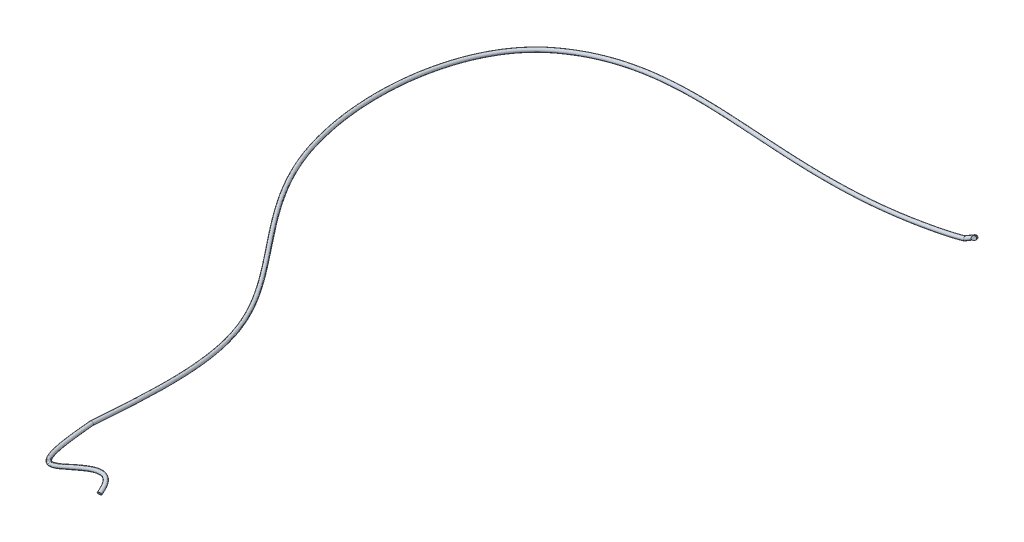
SolidWorks part; units mm, degrees
ref_plane "Plan de face" through (0, 0, 0) normal (0, 0, 1) x (1, 0, 0)
ref_plane "Plan de dessus" through (0, 0, 0) normal (0, 1, 0) x (1, 0, 0)
ref_plane "Plan de droite" through (0, 0, 0) normal (1, 0, 0) x (0, 0, -1)
sketch "Esquisse1" plane through (0, 0, 0) normal (0, 0, 1) x (1, 0, 0)
  circle A0 centre (-0.4672, 0.7119) radius 0.4
sketch "Esquisse5" plane through (0, 0, 0) normal (0, 1, 0) x (1, 0, 0)
  spline S0 degree 3 poles (0, 0) (0.8877, 11.4969) (1.7754, 22.9937) (-6.9183, 46.1293) (-33.5671, 64.9416) (-30.6029, 107.0581) (-3.239, 128.1038) (24.2261, 115.9792) (55.7374, 123.6922) (57.6422, 124.5241) knots 0 0 0 0 0.163429 0.163429 0.386168 0.613276 0.613276 0.943768 1 1 1 1
  spline S4 degree 3 poles (0.4041, 0) (0.6221, 3.0245) (0.9959, 8.2082) (1.1644, 15.515) (0.8905, 20.8142) (0.3247, 24.9342) (-0.2916, 27.9229) (-1.1305, 30.8339) (-2.2194, 33.6401) (-3.5355, 36.3493) (-5.5532, 39.8736) (-8.4741, 44.1244) (-12.3162, 49.0832) (-16.2662, 54.0741) (-20.0823, 59.2419) (-23.5196, 64.7355) (-25.847, 69.6875) (-27.2421, 73.891) (-28.0631, 77.1941) (-28.6537, 80.5771) (-29.1398, 85.1773) (-29.1856, 90.9371) (-28.3616, 97.6737) (-26.669, 103.9662) (-24.505, 108.6996) (-22.3167, 111.984) (-20.6923, 113.8881) (-19.1211, 115.3509) (-17.6984, 116.4498) (-15.9227, 117.5877) (-13.7543, 118.6759) (-10.2291, 119.9806) (-5.4028, 121.0117) (0.7788, 121.5069) (7.3284, 121.4851) (14.1312, 121.1438) (21.0698, 120.6831) (28.0239, 120.3016) (33.767, 120.2153) (38.2769, 120.3929) (42.6133, 120.7639) (46.9492, 121.4913) (52.3352, 122.7003) (55.6096, 123.5683) (57.7735, 124.1419) knots 0 0 0 0 0.044483 0.076237 0.107175 0.122199 0.137212 0.151907 0.166591 0.181315 0.196054 0.226133 0.256878 0.288082 0.319513 0.351079 0.383018 0.39949 0.415991 0.432907 0.449829 0.483815 0.517157 0.549103 0.579075 0.593007 0.606901 0.615682 0.624459 0.633238 0.646588 0.659962 0.688295 0.718635 0.750802 0.784317 0.818551 0.852823 0.886488 0.902764 0.919022 0.95031 0.967162 1 1 1 1 construction
sweep "Balayage1" add profiles "Esquisse1" path "Esquisse5"
sketch "Esquisse6" plane through (96.5575, 0, -51.3539) normal (0.8829, 0, -0.4696) x (-0.4696, 0, -0.8829)
  circle A0 centre (83.339, 0.7107) radius 0.4034
sketch3d "Esquisse3D1"
  line L0 (59.9922, 2.338, -124.3226) -> (59.9922, 2.3919, -123.3441) construction
  circle A0 centre (57.4243, 0.7107, -124.9337) radius 0.4034 construction
  spline S0 degree 3 poles (57.4243, 0.7107, -124.9337) (58.0347, 0.9574, -125.2497) (59.1734, 1.4175, -125.8392) (59.7327, 2.0463, -124.8022) (59.9922, 2.3381, -124.321) knots 0 0 0 0 0.536002 1 1 1 1
  point P8 (57.7805, 0.7107, -125.1231)
sweep "Balayage2" add profiles "Esquisse6" path "Esquisse3D1"
sketch "Esquisse7" plane through (0, 0, 0) normal (0, 0, 1) x (1, 0, 0)
  circle A0 centre (-0.4672, 0.7119) radius 0.4
  circle A1 centre (-0.4672, 0.7119) radius 0.4 construction
sketch3d "Esquisse3D2"
  spline S0 degree 3 poles (-0.4499, 0.7626, 0) (-0.5407, 0.1274, 4.9678) (-0.7466, -1.3131, 16.2344) (16.1132, 7.465, 10.22) (16.8702, 4.6769, 15.212) (16.9323, 4.4483, 15.6213) knots 0 0 0 0 0.419965 0.952448 1 1 1 1
sweep "Balayage3" add profiles "Esquisse7" path "Esquisse3D2"
